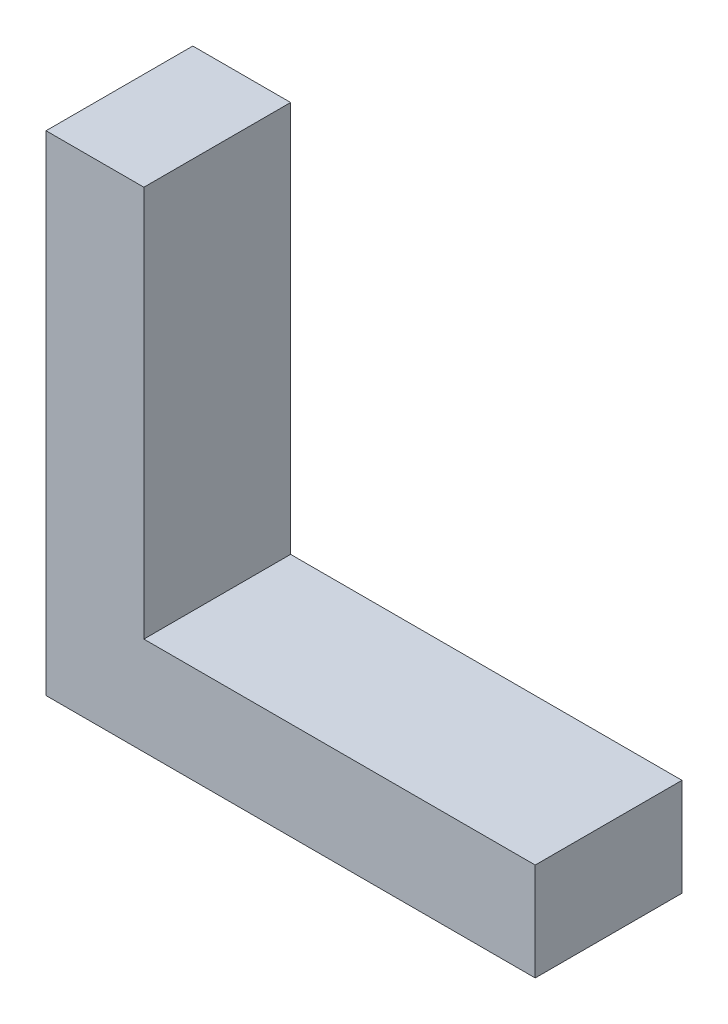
SolidWorks part; units mm, degrees
ref_plane "Front" through (0, 0, 0) normal (0, 0, 1) x (1, 0, 0)
ref_plane "Top" through (0, 0, 0) normal (0, 1, 0) x (1, 0, 0)
ref_plane "Right" through (0, 0, 0) normal (1, 0, 0) x (0, 0, -1)
sketch "Sketch1" plane through (0, 0, 0) normal (0, 0, 1) x (1, 0, 0)
  line L0 (20, 100) -> (20, 20)
  line L1 (0, 0) -> (100, 0)
  line L2 (0, 0) -> (0, 100)
  line L3 (0, 100) -> (20, 100)
  line L4 (100, 0) -> (100, 20)
  line L5 (20, 20) -> (100, 20)
  dimension "D1" = 100
  dimension "D2" = 100
  dimension "D3" = 20
  dimension "D4" = 20
extrude "Extrude1" add sketch "Sketch1" along normal blind 30
fillet "Fillet1" [suppressed] radius 2
